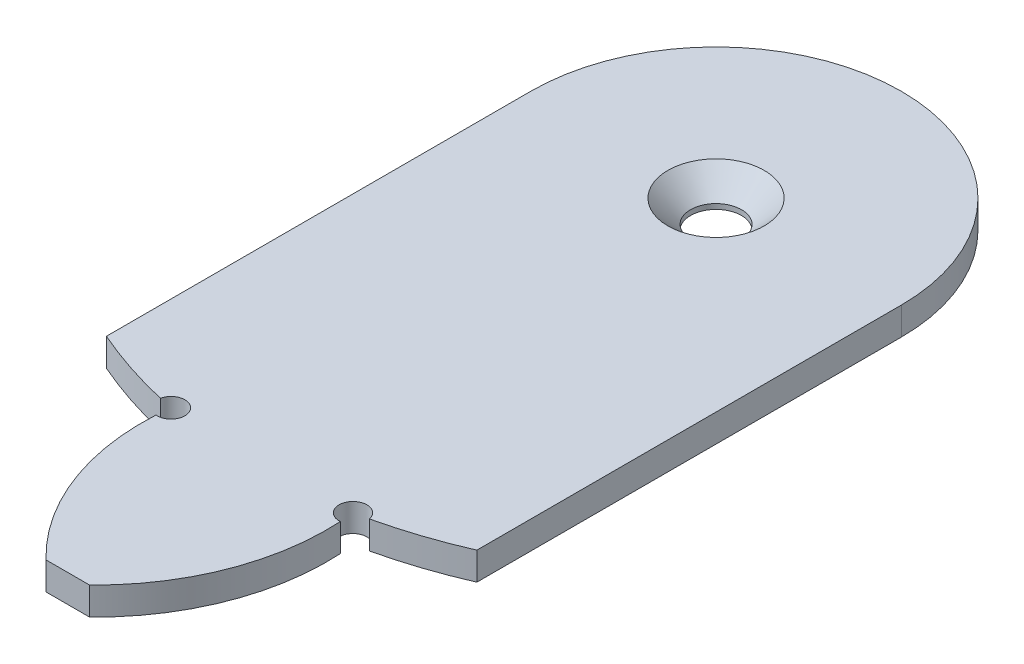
SolidWorks part; units mm, degrees
ref_plane "Front Plane" through (0, 0, 0) normal (0, 0, 1) x (1, 0, 0)
ref_plane "Top Plane" through (0, 0, 0) normal (0, 1, 0) x (1, 0, 0)
ref_plane "Right Plane" through (0, 0, 0) normal (1, 0, 0) x (0, 0, -1)
sketch "Sketch1" plane through (0, 0, 0) normal (0, 1, 0) x (1, 0, 0)
  line L0 (-0.0978, -1.5826) -> (-0.0978, 88.4171) construction
  line L1 (-20, 68.4174) -> (-20, 22.5916)
  line L2 (20, 68.4174) -> (20, 22.5916)
  line L13 (-2.3494, -1.5826) -> (2.3494, -1.5826)
  arc A0 (20, 68.4174) -> (-20, 68.4174) centre (0, 68.4174) ccw
  arc A1 (-20, 22.5916) -> (-11.2886, 19.7084) centre (0, 68.4174) ccw
  arc A3 (2.3494, -1.5826) -> (9.9561, 17.8976) centre (-15, 16.4174) ccw
  arc A4 (-9.9561, 17.8976) -> (-11.2886, 19.7084) centre (-9.8224, 19.3917) ccw
  arc A5 (11.2886, 19.7084) -> (9.9561, 17.8976) centre (9.8224, 19.3917) ccw
  arc A6 (11.2886, 19.7084) -> (20, 22.5916) centre (0, 68.4174) ccw
  arc A9 (-9.9561, 17.8976) -> (-2.3494, -1.5826) centre (15, 16.4174) ccw
  dimension "D1" = 20
  dimension "D5" = 50
  dimension "D6" = 50
  dimension "D7" = 1.5
  dimension "D8" = 1.5
  dimension "D9" = 25
  dimension "D10" = 25
  dimension "D2" = 70
  dimension "D3" = 5
  dimension "D4" = 5
  dimension "D11" = 18
  dimension "D12" = 18
extrude "Extrude1" add sketch "Sketch1" along normal blind 3
hole_wizard "CSK for M5 Countersunk Flat Head Screw1" positions "3DSketch1" profile "Sketch2" countersink size "M5" standard "ISO"
sketch3d "3DSketch1"
  line L0 (0, 3, -68.4174) -> (0, 0, -68.4174) construction
  point P0 (0, 3, -68.4174)
sketch "Sketch2" plane through (0, 3, -68.4174) normal (1, 0, 0) x (0, 0, 1)
  line L0 (0, 0) -> (0, 3)
  line L1 (0, 3) -> (2.75, 3)
  line L2 (2.75, 3) -> (2.75, 2.45)
  line L3 (2.75, 2.45) -> (5.2, 0)
  line L5 (5.2, 0) -> (0, 0)
  line L6 (-2.75, 2.45) -> (-5.2, 0) construction
  line L11 (0, -6.35) -> (0, 107.95) construction
  dimension "Thru Hole Dia." = 5.5
  dimension "Thru Hole Depth" = 3
  dimension "Near C'Sink Dia." = 10.4
  dimension "Near C'Sink Angle" = 90
